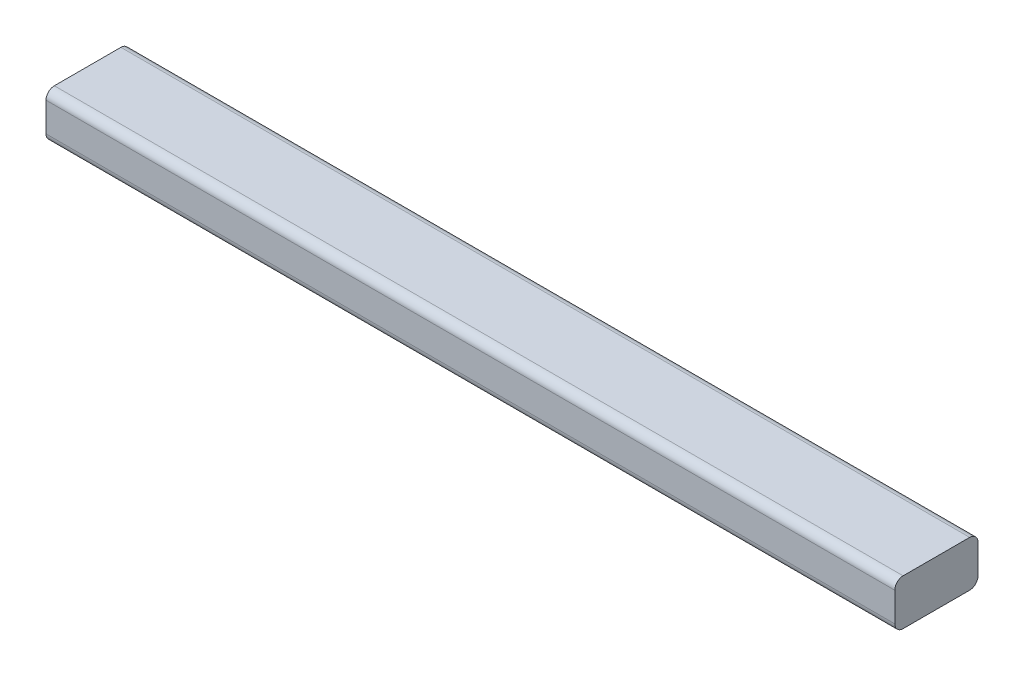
SolidWorks part; units mm, degrees
ref_plane "Bottom Plane" through (0, 0, 0) normal (0, 0, 1) x (1, 0, 0)
ref_plane "Front Plane" through (0, 0, 0) normal (0, 1, 0) x (1, 0, 0)
ref_plane "Left Plane" through (0, 0, 0) normal (1, 0, 0) x (0, 0, -1)
ref_plane "Right Plane" through (647.7, 0, 0) normal (1, 0, 0) x (0, 0, -1)
ref_plane "Back Plane" through (0, 19.05, 0) normal (0, 1, 0) x (1, 0, 0)
ref_plane "Top Plane" through (0, 0, 139.7) normal (0, 0, 1) x (1, 0, 0)
sketch "Sketch2" plane through (0, 0, 0) normal (1, 0, 0) x (0, 0, -1)
  line L1 (0, 0) -> (-63.5, 0)
  line L2 (0, 0) -> (0, 34.925)
  line L3 (0, 34.925) -> (-63.5, 34.925)
  line L4 (-63.5, 0) -> (-63.5, 34.925)
  dimension "D1" = 34.925
  dimension "D2" = 63.5
extrude "Boss-Extrude1" add sketch "Sketch2" along normal up to surface (647.7 mm away)
ref_plane "half length" through (323.85, 0, 0) normal (1, 0, 0) x (0, 0, -1)
ref_plane "Half Width" through (0, 0, 69.85) normal (0, 0, 1) x (1, 0, 0)
fillet "Fillet1" radius 6.35 4 edges at (323.85, 34.925, 63.5) (323.85, 34.925, 0) (323.85, 0, 0) (323.85, 0, 63.5)
